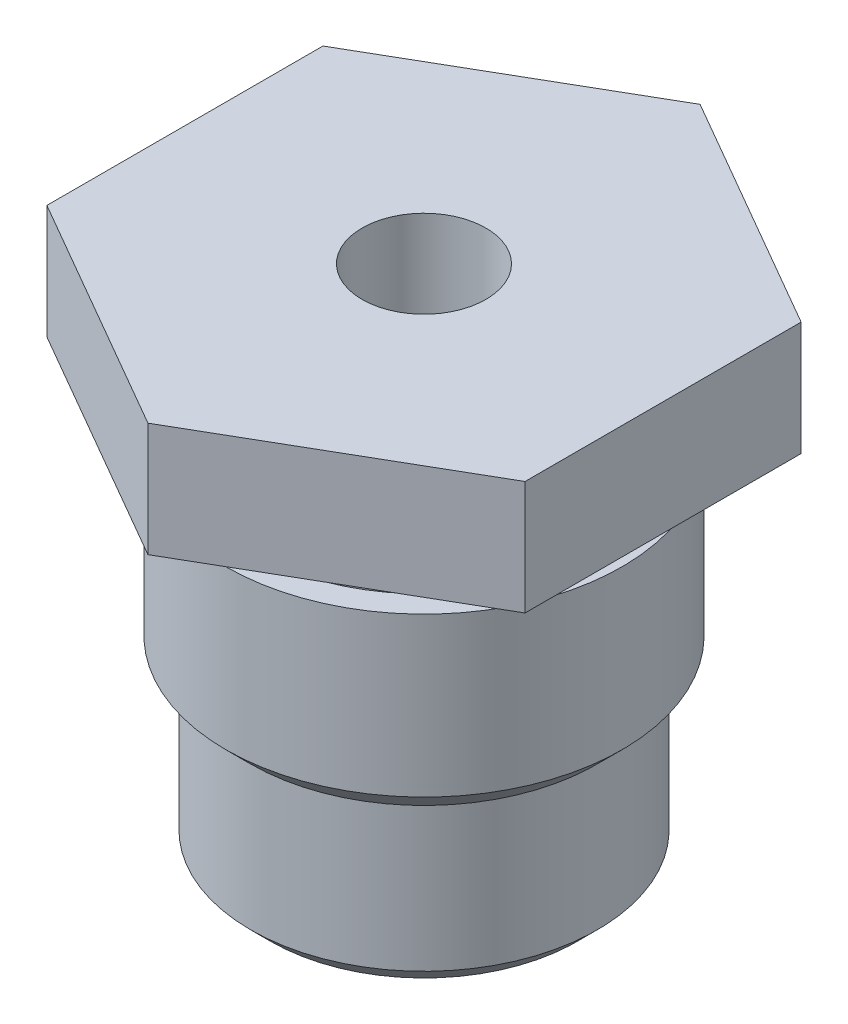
SolidWorks part; units mm, degrees
ref_plane "Plan1" through (0, 0, 0) normal (0, 0, 1) x (1, 0, 0)
ref_plane "Plan2" through (0, 0, 0) normal (0, 1, 0) x (1, 0, 0)
ref_plane "Plan3" through (0, 0, 0) normal (1, 0, 0) x (0, 0, -1)
sketch "Esquisse1" plane through (0, 0, 0) normal (0, 0, 1) x (1, 0, 0)
  line L0 (0, 60) -> (0, -60) construction
  line L1 (-2.6, 0) -> (-3.1, 0)
  line L2 (-3.5, 0.4) -> (-3.5, 3.3)
  line L3 (-3.5, 3.3) -> (-4, 3.8)
  line L4 (-4, 3.8) -> (-4, 7)
  line L5 (-4, 7) -> (-3.5, 7)
  line L6 (-3.5, 7) -> (-3.5, 8)
  line L7 (-2.6, 0) -> (-2.6, 5.73)
  line L8 (-2.6, 5.73) -> (-1.25, 6.5)
  line L9 (-1.25, 6.5) -> (-1.25, 8)
  line L10 (-1.25, 8) -> (-3.5, 8)
  line L11 (-3.5, 0.4) -> (-3.1, 0)
  dimension "D1" = 2.5
  dimension "D2" = 5.2
  dimension "D3" = 7
  dimension "D4" = 8
  dimension "D5" = 7
  dimension "D6" = 3.3
  dimension "D7" = 0.5
  dimension "D8" = 3.2
  dimension "D9" = 1
  dimension "D10" = 5.73
  dimension "D11" = 1.5
  dimension "D12" = 135
  dimension "D13" = 0.5
revolve "Base-Révolution" add sketch "Esquisse1" angle 360 about L0
sketch "Esquisse2" plane through (0, 8, 0) normal (0, 1, 0) x (-1, 0, 0)
  line L0 (0, -10) -> (0, 10) construction
  line L1 (0, 5.575) -> (-4.8281, 2.7875)
  line L2 (-4.8281, 2.7875) -> (-4.8281, -2.7875)
  line L3 (-4.8281, -2.7875) -> (0, -5.575)
  line L4 (0, -5.575) -> (4.8281, -2.7875)
  line L5 (4.8281, -2.7875) -> (4.8281, 2.7875)
  line L6 (4.8281, 2.7875) -> (0, 5.575)
  circle A0 centre (0, 0) radius 4.8281 construction
  circle A1 centre (0, 0) radius 1.25 construction
  circle A2 centre (0, 0) radius 1.25
  circle A3 centre (0, 0) radius 4 construction
  dimension "D1" = 11.15
extrude "Boss.-Extru.1" add sketch "Esquisse2" along normal blind 2.3
